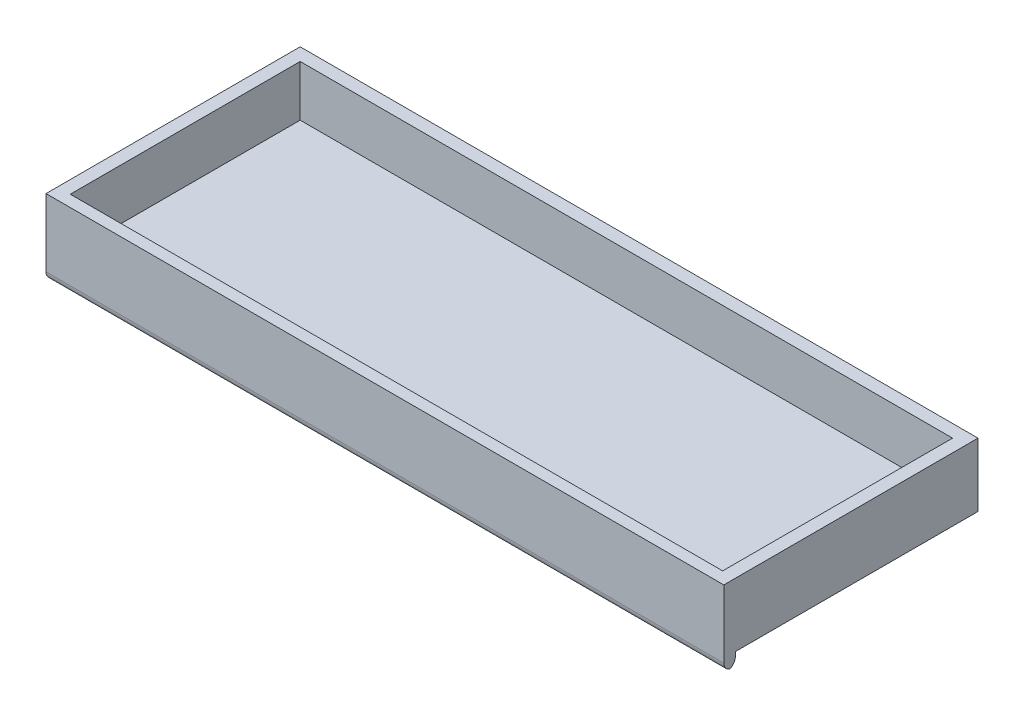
SolidWorks part; units mm, degrees
ref_plane "Front Plane" through (0, 0, 0) normal (0, 0, 1) x (1, 0, 0)
ref_plane "Top Plane" through (0, 0, 0) normal (0, 1, 0) x (1, 0, 0)
ref_plane "Right Plane" through (0, 0, 0) normal (1, 0, 0) x (0, 0, -1)
sketch "Sketch1" plane through (0, 0, 0) normal (0, 1, 0) x (1, 0, 0)
  line L1 (-203.2, -76.2) -> (203.2, -76.2)
  line L2 (-203.2, -76.2) -> (-203.2, 76.2)
  line L3 (-203.2, 76.2) -> (203.2, 76.2)
  line L4 (203.2, -76.2) -> (203.2, 76.2)
  line L5 (-203.2, -76.2) -> (203.2, 76.2) construction
  line L6 (-203.2, 76.2) -> (203.2, -76.2) construction
  point P0 (0, 0)
  dimension "D1" = 152.4
  dimension "D2" = 406.4
extrude "Boss-Extrude1" add sketch "Sketch1" along normal blind 38.1
sketch "Sketch2" plane through (0, 38.1, 0) normal (0, 1, 0) x (1, 0, 0)
  line L0 (-203.2, 76.2) -> (-203.2, -76.2) construction
  line L1 (-195.58, 68.58) -> (195.58, 68.58)
  line L2 (-195.58, 68.58) -> (-195.58, -69.2645)
  line L3 (-195.58, -69.2645) -> (195.58, -69.2645)
  line L4 (195.58, 68.58) -> (195.58, -69.2645)
  line L5 (203.2, 76.2) -> (-203.2, 76.2) construction
  line L6 (203.2, -76.2) -> (203.2, 76.2) construction
  dimension "D1" = 7.62
  dimension "D2" = 7.62
  dimension "D3" = 7.62
extrude "Cut-Extrude1" cut sketch "Sketch2" against normal blind 30.48
sketch "Sketch3" plane through (0, 0, 76.2) normal (0, 0, 1) x (1, 0, 0)
  line L1 (-203.2, 38.1) -> (203.2, 38.1)
  line L2 (-203.2, 38.1) -> (-203.2, -7.62)
  line L3 (-203.2, -7.62) -> (203.2, -7.62)
  line L4 (203.2, 38.1) -> (203.2, -7.62)
  dimension "D1" = 45.72
  dimension "D2" = 406.4
extrude "Boss-Extrude3" add sketch "Sketch3" against normal up to surface (6.9355 mm away)
fillet "Fillet2" radius 5.08 2 edges at (0, -7.62, 69.2645) (0, -7.62, 76.2)
